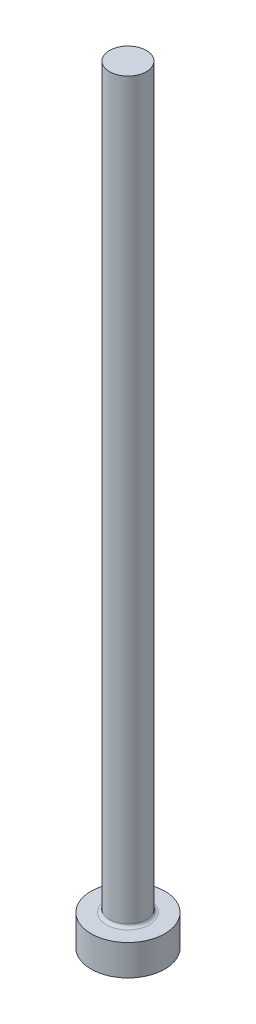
SolidWorks part; units mm, degrees
ref_plane "Plano frontal" through (0, 0, 0) normal (0, 0, 1) x (1, 0, 0)
ref_plane "Plano superior" through (0, 0, 0) normal (0, 1, 0) x (1, 0, 0)
ref_plane "Plano direito" through (0, 0, 0) normal (1, 0, 0) x (0, 0, -1)
sketch "Esboço1" plane through (0, 0, 0) normal (0, 0, 1) x (1, 0, 0)
  line L0 (0, 0) -> (6, 0)
  line L1 (6, 0) -> (6, 5)
  line L2 (6, 5) -> (3.5, 5)
  line L3 (3, 5.5) -> (3, 125)
  line L4 (3, 125) -> (0, 125)
  line L5 (0, 125) -> (0, 0) construction
  line L6 (0, 0) -> (0, 125)
  arc A0 (3.5, 5) -> (3, 5.5) centre (3.5, 5.5) cw
  dimension "D3" = 0.5
  dimension "D1" = 12
  dimension "D2" = 6
  dimension "D4" = 5
  dimension "D5" = 125
revolve "Revolução1" add sketch "Esboço1" angle 360 about L5
sketch "Esboço2"
  dimension "D1" = 3.225
  dimension "D2" = 1.05
  dimension "D3" = 0.675
  dimension "D4" = 0.45
wrap "Envolver1" sketch "Esboço2" source sketch "Esboço2" thickness 0.1 parameters "D1"=0.1
